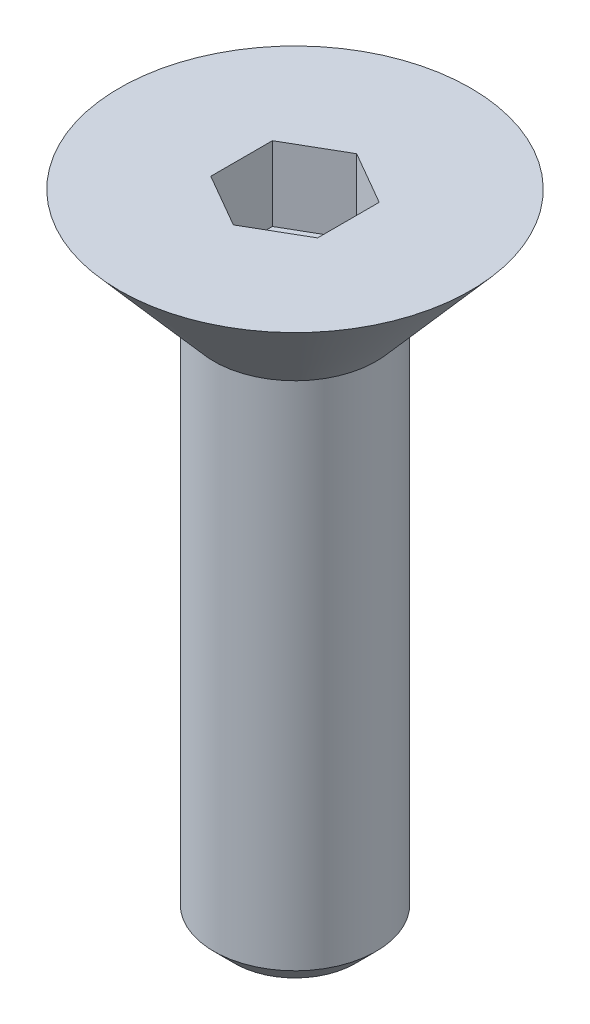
SolidWorks part; units mm, degrees
ref_plane "Front" through (0, 0, 0) normal (0, 0, 1) x (1, 0, 0)
ref_plane "Top" through (0, 0, 0) normal (0, 1, 0) x (1, 0, 0)
ref_plane "Right" through (0, 0, 0) normal (1, 0, 0) x (0, 0, -1)
sketch "Sketch1" plane through (0, 0, 0) normal (0, 0, 1) x (1, 0, 0)
  line L0 (0, 0) -> (2.413, 0)
  line L1 (2.413, 0) -> (5.2197, 3.2258)
  line L2 (5.2197, 3.2258) -> (0, 3.2258)
  line L3 (0, 3.2258) -> (0, 0)
  line L4 (0, 0) -> (0, 100) construction
revolve "Base-Revolve" add sketch "Sketch1" angle 360 about L4
sketch "Sketch2" plane through (0, 0, 0) normal (0, 0, 1) x (1, 0, 0)
  line L0 (0, 0) -> (0, 100) construction
  line L1 (0, -15.8242) -> (1.7831, -15.8242)
  line L2 (1.7831, -15.8242) -> (2.413, -15.1943)
  line L3 (2.413, -15.1943) -> (2.413, 0)
  line L4 (2.413, 0) -> (0, 0)
  line L5 (0, 0) -> (0, -15.8242)
  line L6 (5.2197, 3.2258) -> (-5.2197, 3.2258) construction
  dimension "D1" = 19.05
revolve "Boss-Revolve1" add sketch "Sketch2" angle 360 about L0
ref_plane "Plane4" through (0, 3.2258, 0) normal (0, 1, 0) x (-1, 0, 0)
sketch "Sketch3" plane through (0, 3.2258, 0) normal (0, 1, 0) x (-1, 0, 0)
  line L0 (1.5875, 0.9165) -> (0, 1.8331)
  line L1 (0, 1.8331) -> (-1.5875, 0.9165)
  line L2 (-1.5875, 0.9165) -> (-1.5875, -0.9165)
  line L3 (-1.5875, -0.9165) -> (0, -1.8331)
  line L4 (0, -1.8331) -> (1.5875, -0.9165)
  line L5 (1.5875, -0.9165) -> (1.5875, 0.9165)
extrude "Cut-Extrude1" cut sketch "Sketch3" against normal blind 2.2098
